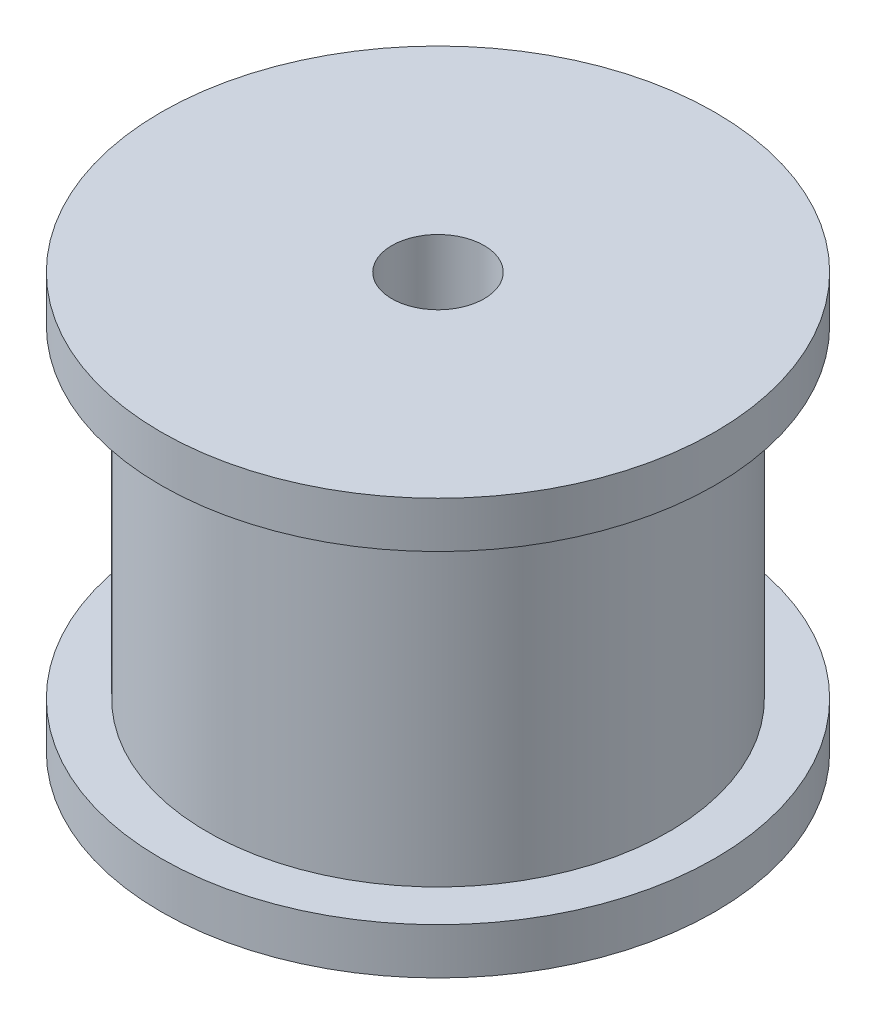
SolidWorks part; units mm, degrees
ref_plane "Front Plane" through (0, 0, 0) normal (0, 0, 1) x (1, 0, 0)
ref_plane "Top Plane" through (0, 0, 0) normal (0, 1, 0) x (1, 0, 0)
ref_plane "Right Plane" through (0, 0, 0) normal (1, 0, 0) x (0, 0, -1)
sketch "Sketch1" plane through (0, 0, 0) normal (0, 0, 1) x (1, 0, 0)
  line L0 (0, 0) -> (0, 9) construction
  line L1 (1, 0) -> (1, 9)
  line L2 (1, 9) -> (6, 9)
  line L3 (6, 9) -> (6, 8)
  line L4 (6, 8) -> (5, 8)
  line L5 (5, 8) -> (5, 1)
  line L6 (5, 1) -> (6, 1)
  line L7 (6, 1) -> (6, 0)
  line L8 (6, 0) -> (1, 0)
  line L9 (1, 9) -> (0, 9) construction
  line L10 (0, 9) -> (0, 0) construction
  line L11 (0, 0) -> (1, 0) construction
  dimension "D1" = 9
  dimension "D2" = 2
  dimension "D3" = 10
  dimension "D4" = 12
  dimension "D5" = 7
revolve "Revolve1" add sketch "Sketch1" angle 360 about L0
